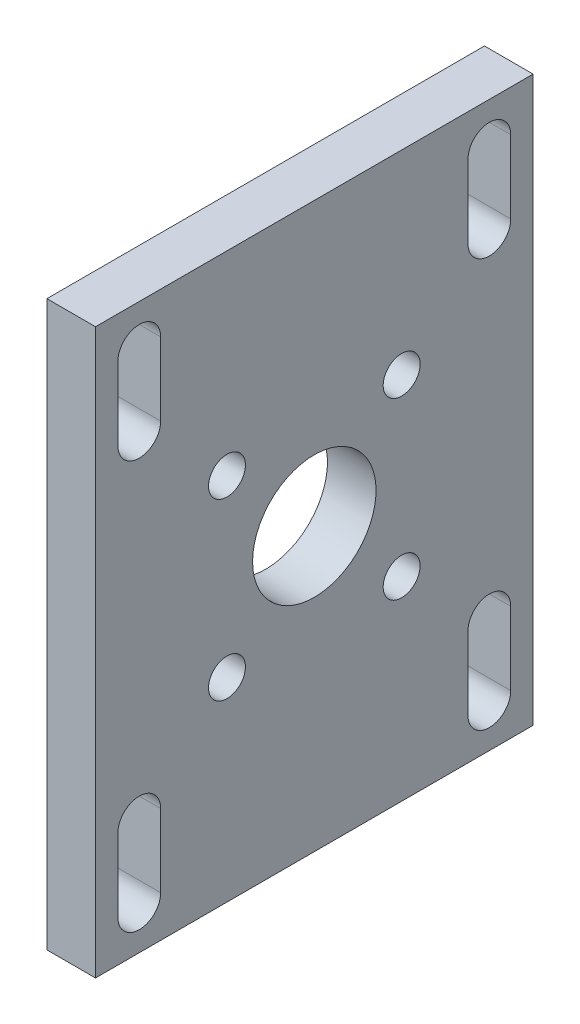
SolidWorks part; units mm, degrees
ref_plane "Front Plane" through (0, 0, 0) normal (0, 0, 1) x (1, 0, 0)
ref_plane "Top Plane" through (0, 0, 0) normal (0, 1, 0) x (1, 0, 0)
ref_plane "Right Plane" through (0, 0, 0) normal (1, 0, 0) x (0, 0, -1)
sketch "Sketch1" plane through (0, 0, 0) normal (1, 0, 0) x (0, 0, -1)
  line L1 (-22.5, -29) -> (22.5, -29)
  line L2 (-22.5, -29) -> (-22.5, 29)
  line L3 (-22.5, 29) -> (22.5, 29)
  line L4 (22.5, -29) -> (22.5, 29)
  line L5 (-22.5, -29) -> (22.5, 29) construction
  line L6 (-22.5, 29) -> (22.5, -29) construction
  point P0 (0, 0)
  dimension "D1" = 45
  dimension "D2" = 58
extrude "Boss-Extrude1" add sketch "Sketch1" along normal blind 5
sketch "Sketch2" plane through (0, 0, 0) normal (-1, 0, 0) x (0, 0, 1)
  circle A0 centre (0, 0) radius 6.35
  dimension "D1" = 12.7
extrude "Cut-Extrude1" cut sketch "Sketch2" against normal through all
hole_wizard "CSK for #6 Flat Head Machine Screw1" positions "Sketch6" profile "Sketch5" countersink size "#6" standard "ANSI Inch"
sketch "Sketch6" plane through (0, 0, 0) normal (-1, 0, 0) x (0, 0, 1)
  point P0 (-8.9803, 8.9803)
  point P3 (8.9803, 8.9803)
  point P6 (8.9803, -8.9803)
  point P9 (-8.9803, -8.9803)
sketch "Sketch5" plane through (0, 8.9803, -8.9803) normal (0, 1, 0) x (0, 0, 1)
  line L0 (0, 0) -> (0, 5)
  line L1 (0, 5) -> (1.8986, 5)
  line L2 (1.8986, 5) -> (1.8986, 1.892)
  line L3 (1.8986, 1.892) -> (3.5433, 0)
  line L5 (3.5433, 0) -> (0, 0)
  line L6 (-1.8986, 1.892) -> (-3.5433, 0) construction
  line L11 (0, -6.35) -> (0, 107.95) construction
  dimension "Thru Hole Dia." = 3.7973
  dimension "Thru Hole Depth" = 5
  dimension "Near C'Sink Dia." = 7.0866
  dimension "Near C'Sink Angle" = 82
sketch "Sketch8" plane through (0, 0, 0) normal (-1, 0, 0) x (0, 0, 1)
  line L0 (-18, -24.75) -> (-18, -17.25) construction
  line L1 (-20.2, -24.75) -> (-20.2, -17.25)
  line L2 (-15.8, -24.75) -> (-15.8, -17.25)
  arc A0 (-20.2, -24.75) -> (-15.8, -24.75) centre (-18, -24.75) ccw
  arc A1 (-15.8, -17.25) -> (-20.2, -17.25) centre (-18, -17.25) ccw
  point P2 (-18, -21)
  dimension "D1" = 2.2
  dimension "D2" = 7.5
  dimension "D3" = 18
  dimension "D4" = 21
extrude "Cut-Extrude2" cut sketch "Sketch8" against normal through all
pattern_linear "LPattern1" count 2 spacing 36 along (0, 0, 1) count 2 spacing 42 along (0, 1, 0) of "Cut-Extrude2"
